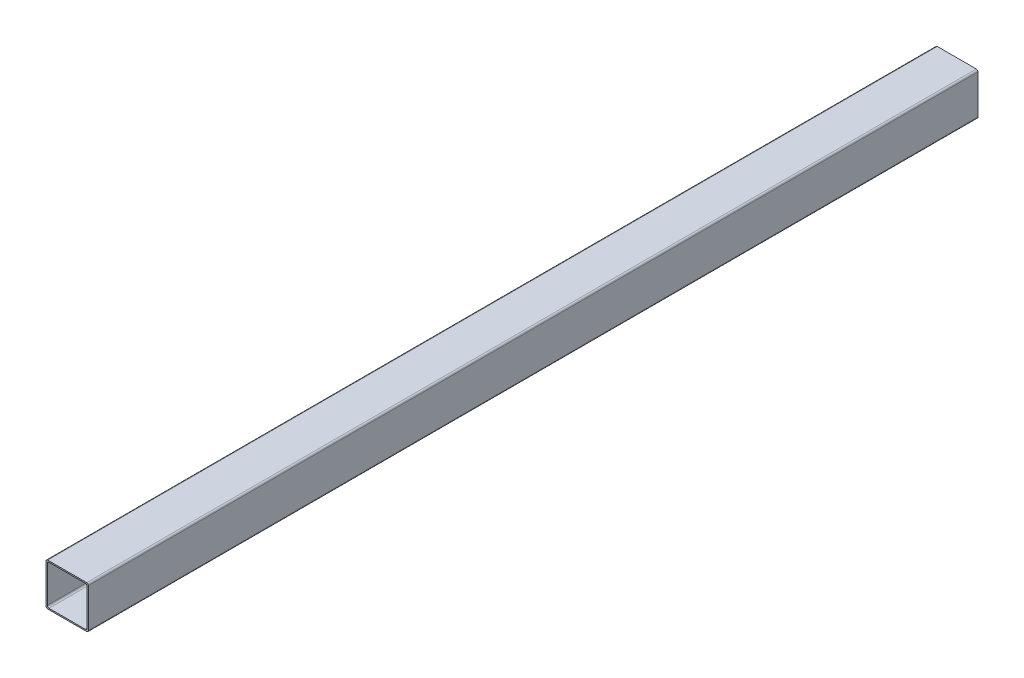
SolidWorks part; units mm, degrees
ref_plane "Plan de face" through (0, 0, 0) normal (0, 0, 1) x (1, 0, 0)
ref_plane "Plan de dessus" through (0, 0, 0) normal (0, 1, 0) x (1, 0, 0)
ref_plane "Plan de droite" through (0, 0, 0) normal (1, 0, 0) x (0, 0, -1)
sketch "Esquisse1" plane through (0, 0, 0) normal (0, 0, 1) x (1, 0, 0)
  line L1 (0, 0) -> (100, 0)
  line L2 (0, 0) -> (0, 100)
  line L3 (0, 100) -> (100, 100)
  line L4 (100, 0) -> (100, 100)
  dimension "D1" = 100
  dimension "D2" = 100
extrude "Extru.-Mince1" add sketch "Esquisse1" along normal blind 2100 thin
fillet "Congé1" radius 4 8 edges at (100, 0, 1050) (0, 0, 1050) (0, 100, 1050) (100, 100, 1050) (3, 3, 1050) (97, 3, 1050) (97, 97, 1050) (3, 97, 1050)
